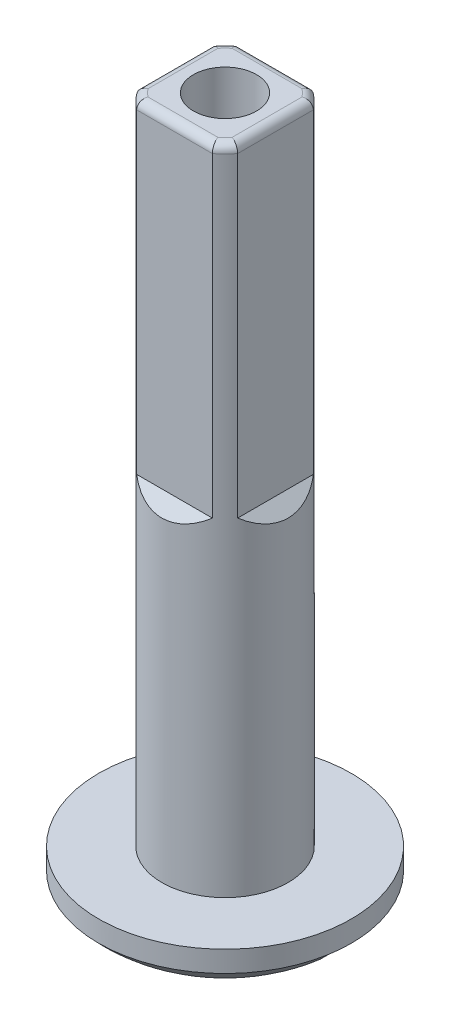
SolidWorks part; units mm, degrees
ref_plane "Front Plane" through (0, 0, 0) normal (0, 0, 1) x (1, 0, 0)
ref_plane "Top Plane" through (0, 0, 0) normal (0, 1, 0) x (1, 0, 0)
ref_plane "Right Plane" through (0, 0, 0) normal (1, 0, 0) x (0, 0, -1)
sketch "cerc 1" plane through (0, 0, 0) normal (0, 1, 0) x (1, 0, 0)
  circle A0 centre (0, 0) radius 1.5
  dimension "D1" = 3
sketch "capacel" plane through (0, 0, 0) normal (0, 0, 1) x (1, 0, 0)
  line L0 (0, 0) -> (-3, 0)
  line L1 (0, 0) -> (0, -1.5)
  line L2 (0, -1.5) -> (-0.7639, -1.5)
  line L3 (-3, 0) -> (-3, -0.5)
  arc A0 (-3, -0.5) -> (-0.7639, -1.5) centre (-0.7639, 1.5) ccw
  dimension "D3" = 0.5
  dimension "D4" = 3
  dimension "D1" = 3
  dimension "D2" = 1.5
extrude "Boss-Extrude1" add sketch "cerc 1" along normal blind 15.5
revolve "Revolve1" add sketch "capacel" angle 360 about L1
sketch "Sketch5" plane through (0, 15.5, 0) normal (0, 1, 0) x (1, 0, 0)
  line L1 (1.2, -1.2) -> (-1.2, -1.2)
  line L2 (1.2, -1.2) -> (1.2, 1.2)
  line L3 (1.2, 1.2) -> (-1.2, 1.2)
  line L4 (-1.2, -1.2) -> (-1.2, 1.2)
  line L5 (1.2, -1.2) -> (-1.2, 1.2) construction
  line L6 (1.2, 1.2) -> (-1.2, -1.2) construction
  line L7 (1.6455, -1.6455) -> (-1.6455, -1.6455)
  line L8 (1.6455, -1.6455) -> (1.6455, 1.6455)
  line L9 (1.6455, 1.6455) -> (-1.6455, 1.6455)
  line L10 (-1.6455, -1.6455) -> (-1.6455, 1.6455)
  line L11 (1.6455, -1.6455) -> (-1.6455, 1.6455) construction
  line L12 (1.6455, 1.6455) -> (-1.6455, -1.6455) construction
  point P0 (0, 0)
  point P5 (0, 0)
  dimension "D1" = 1.2
extrude "Cut-Extrude10" cut sketch "Sketch5" against normal blind 8
sketch "Sketch1" plane through (0, 15.5, 0) normal (0, 1, 0) x (1, 0, 0)
  line L1 (1.0607, 1.0607) -> (-1.0607, 1.0607)
  line L2 (1.0607, 1.0607) -> (1.0607, -1.0607)
  line L3 (1.0607, -1.0607) -> (-1.0607, -1.0607)
  line L4 (-1.0607, 1.0607) -> (-1.0607, -1.0607)
  line L5 (1.0607, 1.0607) -> (-1.0607, -1.0607) construction
  line L6 (1.0607, -1.0607) -> (-1.0607, 1.0607) construction
  circle A3 centre (0, 0) radius 1.5 construction
  circle A4 centre (0, 0) radius 1.5
  point P0 (0, 0)
sketch "Sketch2" plane through (0, 15.5, 0) normal (0, 1, 0) x (1, 0, 0)
  circle A0 centre (0, 0) radius 0.75
  dimension "D1" = 1.5
extrude "Cut-Extrude4" cut sketch "Sketch2" against normal through all
sketch "Sketch4" plane through (0, 0, 0) normal (1, 0, 0) x (0, 0, -1)
  line L1 (-0.5, -0.5) -> (0.5, -0.5)
  line L2 (-0.5, -0.5) -> (-0.5, -2.5368)
  line L3 (-0.5, -2.5368) -> (0.5, -2.5368)
  line L4 (0.5, -0.5) -> (0.5, -2.5368)
  dimension "D1" = 1
  dimension "D2" = 0.5
  dimension "D3" = 0.5
extrude "Cut-Extrude6" cut sketch "Sketch4" against normal mid plane 8
fillet "Fillet1" radius 0.2 8 edges at (0, 15.5, -1.2) (-1.2, 15.5, 0) (0, 15.5, 1.2) (1.2, 15.5, 0) (-1.0607, 15.5, 1.0607) (-1.0607, 15.5, -1.0607) (1.0607, 15.5, -1.0607) (1.0607, 15.5, 1.0607)
chamfer "Chamfer1" distance 0.3 angle 45 4 edges at (1.2, 7.5, 0) (0, 7.5, -1.2) (-1.2, 7.5, 0) (0, 7.5, 1.2)
